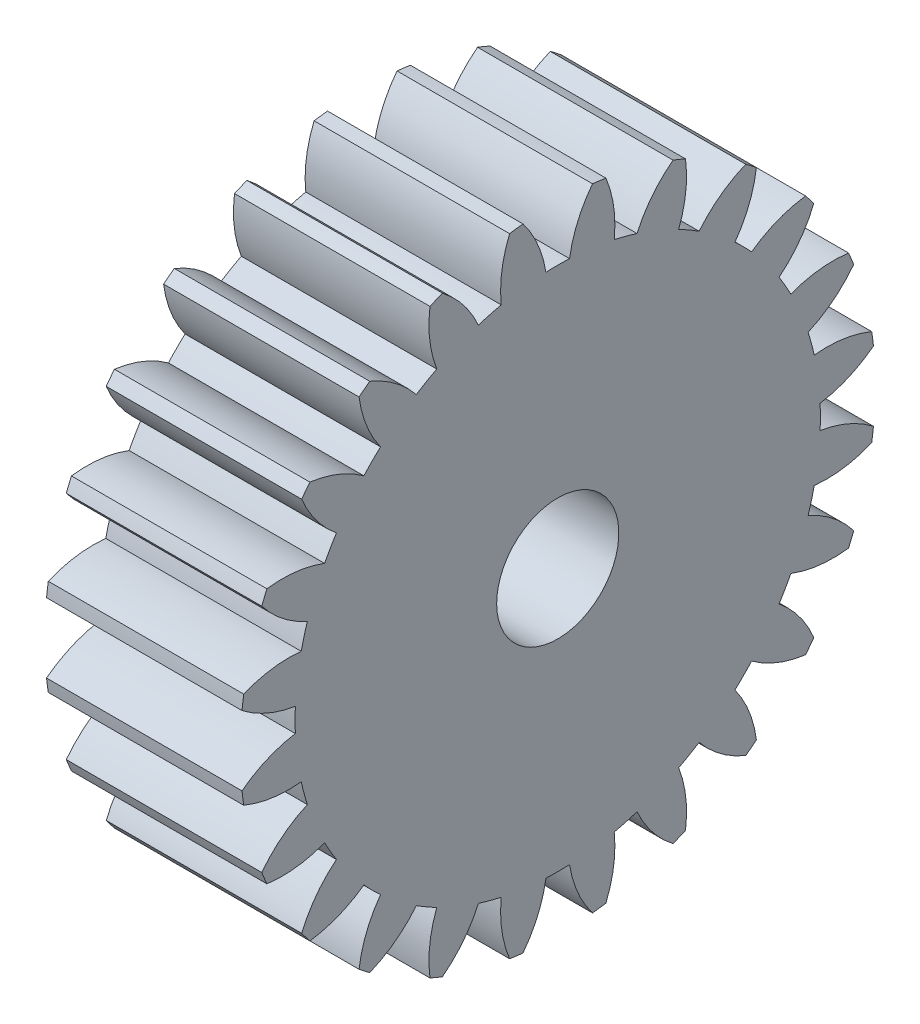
SolidWorks part; units mm, degrees
ref_plane "Plane1" through (0, 0, 0) normal (0, 0, 1) x (1, 0, 0)
ref_plane "Plane2" through (0, 0, 0) normal (0, 1, 0) x (1, 0, 0)
ref_plane "Plane3" through (0, 0, 0) normal (1, 0, 0) x (0, 0, -1)
sketch "HoldingSke" plane through (0, 0, 0) normal (0, 1, 0) x (1, 0, 0)
  line L0 (0, 0) -> (0.9135, -0.4067)
  line L1 (-15, 0) -> (100, 0) construction
  line L2 (0, 0) -> (-2.1039, 2.3779)
  line L3 (0, 0) -> (-11.863, 4.5341)
  line L4 (0, 0) -> (7.8894, 3.5126)
  line L5 (0, 0) -> (-46.8476, -17.4728)
  line L6 (0, 0) -> (-6.6317, -4.4744)
  line L7 (-2.1039, 2.3779) -> (8.6586, 51.2059)
  line L8 (-76.2, 54.61) -> (-75.3, 54.61)
  line L9 (-71.009, 38.7566) -> (-53.1078, 45.2721)
  line L10 (-76.2, 71.12) -> (104.1128, 71.12)
  line L11 (0, 0) -> (-8, 0)
  line L12 (-76.2, 101.6) -> (-76.162, 101.6)
  line L13 (24.9733, 27.94) -> (52.9518, 28.4284)
  line L14 (24.9733, 27.94) -> (24.9743, 27.94)
  line L15 (24.9733, 27.94) -> (100.4006, 29.5858)
  line L16 (-63.627, -1) -> (-12.827, -1)
  circle A0 centre (0, 0) radius 2.5
  circle A1 centre (0, 0) radius 10.749
  circle A2 centre (0, 0) radius 37.5
  circle A3 centre (0, 0) radius 2.5
sketch "BasProSke" plane through (0, 0, 0) normal (0, 1, 0) x (1, 0, 0)
  line L0 (-10, 0) -> (60, 0) construction
  line L1 (0, 0) -> (0, 13)
  line L2 (0, 0) -> (8, 0)
  line L3 (8, 0) -> (8, 13)
  line L4 (8, 13) -> (0, 13)
revolve "Base-Revolve" add sketch "BasProSke" angle 360 about L0
sketch "TooCutSke" plane through (0, 0, 0) normal (1, 0, 0) x (0, 0, -1)
  line L1 (0, 0) -> (0, 107) construction
  line L2 (0, 0) -> (-0.8513, 11.9698) construction
  line L3 (0, 0) -> (-3.127, 23.752) construction
  line L4 (-0.8513, 11.9698) -> (-1.5635, 11.876) construction
  arc A0 (0.4834, 10.7381) -> (-0.4834, 10.7381) centre (0, 0) ccw
  arc A1 (1.4409, 12.9455) -> (-1.4409, 12.9455) centre (0, 0) ccw
  circle A2 centre (0, 0) radius 12 construction
  circle A3 centre (0, 0) radius 11.2763 construction
  arc A4 (-0.4834, 10.7381) -> (-1.4409, 12.9455) centre (-5.2252, 9.9926) ccw
  arc A5 (1.4409, 12.9455) -> (0.4834, 10.7381) centre (5.2252, 9.9926) ccw
extrude "ToothCut" cut sketch "TooCutSke" along normal through all
fillet "Breaks" [suppressed] radius 0.02
fillet "RootFillets" [suppressed] radius 0.251
pattern_circular "TeethCuts" count 24 every 15 about axis through (-10, 0, 0) along (1, 0, 0) of "ToothCut", "RootFillets", "Breaks"
sketch "HubNeaOneSke" plane through (0, 0, 0) normal (-1, 0, 0) x (0, 0, 1)
  circle A0 centre (0, 0) radius 10.749
extrude "HubNearOne" [suppressed] add sketch "HubNeaOneSke" along normal blind 42.0001
sketch "HubNeaBotSke" plane through (0, 0, 0) normal (-1, 0, 0) x (0, 0, 1)
  circle A0 centre (0, 0) radius 10.749
extrude "HubNearBoth" [suppressed] add sketch "HubNeaBotSke" along normal blind 21
ref_plane "FarPln" through (8, 0, 0) normal (1, 0, 0) x (0, 0, -1)
sketch "HubFarSke" plane through (8, 0, 0) normal (1, 0, 0) x (0, 0, -1)
  circle A0 centre (0, 0) radius 10.749
extrude "HubFar" [suppressed] add sketch "HubFarSke" along normal blind 21
sketch "BorSke" plane through (0, 0, 0) normal (1, 0, 0) x (0, 0, -1)
  circle A0 centre (0, 0) radius 2.5
extrude "Bore" cut sketch "BorSke" along normal mid plane 100.0001
sketch "KeySke" plane through (0, 0, 0) normal (1, 0, 0) x (0, 0, -1)
  line L0 (-1, 0) -> (-1, 3.4)
  line L1 (-1, 3.4) -> (1, 3.4)
  line L2 (1, 3.4) -> (1, 0)
  line L3 (0, 0) -> (0, 34) construction
  line L4 (-1, 0) -> (1, 0)
extrude "Keyway" [suppressed] cut sketch "KeySke" along normal mid plane 100.0001
pattern_circular "Keyway2" [suppressed] count 2 every 90 about axis through (-10, 0, 0) along (1, 0, 0)
equation "' \"Module@HoldingSke\" = 6.35"
equation "' \"Num_teeth@HoldingSke\" = 12"
equation "' \"Ap@HoldingSke\" =  20"
equation "' \"Ap@HoldingSke\" = 20"
equation "' \"Width@HoldingSke\" = 0.5 * 25.4"
equation "' \"Hub_dia@HoldingSke\"= 1 * 25.4"
equation "' \"Hub_dia@HoldingSke\" = 1 * 25.4"
equation "' \"Overall_len@HoldingSke\" = 1.0 * 25.4"
equation "' \"Bore@HoldingSke\" = 0.75 * 25.4"
equation "' \"T_dim@HoldingSke\" = 0.1 * 25.4"
equation "' \"Width@KeySke\" = 0.25 * 25.4"
equation "' \"Show_teeth@HoldingSke\" = 13"
equation "' \"Backlash@HoldingSke\" = 0.009 * 25.4"
equation "' \"Addendum_fac@HoldingSke\" = 1.0"
equation "' \"Dedendum_fac@HoldingSke\" = 1.25"
equation "' \"Dedendum_add@HoldingSke\" = 0.00005 * 25.4"
equation "' \"Clearance_fac@HoldingSke\" = 0.25"
equation "\"Pitch@HoldingSke\" = 1 / \"Module@HoldingSke\""
equation "\"Overcut_dia@TooCutSke\" = (\"Num_teeth@HoldingSke\" + 2 * \"Addendum_fac@HoldingSke\") / \"Pitch@HoldingSke\" + 0.002 * 25.4"
equation "\"Pitch_dia@TooCutSke\" = \"Num_teeth@HoldingSke\" / \"Pitch@HoldingSke\""
equation "\"Base_dia@TooCutSke\" = \"Num_teeth@HoldingSke\" / \"Pitch@HoldingSke\" * cos((\"Ap@HoldingSke\"  * 3.14159265 / 180))"
equation "\"Root_dia@TooCutSke\" = (\"Num_teeth@HoldingSke\" + 2) / \"Pitch@HoldingSke\" - 2 * (\"Addendum_fac@HoldingSke\" + \"Dedendum_fac@HoldingSke\") / \"Pitch@HoldingSke\" - \"Dedendum_add@HoldingSke\" * 2"
equation "\"Half_ang@TooCutSke\" = 180 / \"Num_teeth@HoldingSke\""
equation "\"Half_CT@TooCutSke\" = \"Num_teeth@HoldingSke\" / \"Pitch@HoldingSke\" * sin((3.14159265 / 2 / \"Num_teeth@HoldingSke\")) / 2 - 7 * \"Backlash@HoldingSke\" / 4"
equation "\"Flank_rad@TooCutSke\" = \"Num_teeth@HoldingSke\" / \"Pitch@HoldingSke\" / 5"
equation "\"Radius@RootFillets\" = \"Clearance_fac@HoldingSke\" / \"Pitch@HoldingSke\" + \"Dedendum_add@HoldingSke\""
equation "\"Break_rad@Breaks\" = 0.02 / \"Pitch@HoldingSke\""
equation "\"Thickness@HoldingSke\" = \"Width@HoldingSke\""
equation "\"OAL@HoldingSke\" = \"Thickness@HoldingSke\""
equation "\"MHD@HoldingSke\" = (\"Num_teeth@HoldingSke\" + 2) / \"Pitch@HoldingSke\" - 2 * (\"Addendum_fac@HoldingSke\" + \"Dedendum_fac@HoldingSke\")  / \"Pitch@HoldingSke\" - \"Dedendum_add@HoldingSke\" * 2"
equation "\"MBD@HoldingSke\" = (\"Num_teeth@HoldingSke\" + 2) / \"Pitch@HoldingSke\" - 2 * (\"Addendum_fac@HoldingSke\" + \"Dedendum_fac@HoldingSke\")  / \"Pitch@HoldingSke\" - \"Dedendum_add@HoldingSke\" * 2 - 0.002 * 25.4"
equation "\"MHD@HoldingSke\" = ((sgn( \"MHD@HoldingSke\" - \"Hub_dia@HoldingSke\" )-1)*( \"MHD@HoldingSke\" - \"Hub_dia@HoldingSke\" ))/-2+ \"Hub_dia@HoldingSke\""
equation "\"MBD@HoldingSke\" = ((sgn( \"MBD@HoldingSke\" - \"Bore@HoldingSke\" )-1)*( \"MBD@HoldingSke\" - \"Bore@HoldingSke\" ))/-2+ \"Bore@HoldingSke\""
equation "\"OAL@HoldingSke\" = ((sgn( \"OAL@HoldingSke\" - \"Overall_len@HoldingSke\" )+1)*( \"OAL@HoldingSke\" - \"Overall_len@HoldingSke\" ))/2 + \"Overall_len@HoldingSke\" + 0.000002 * 25.4"
equation "\"Num_teeth@TeethCuts\" = int( \"Show_teeth@HoldingSke\" ) + 1"
equation "\"Num_teeth@TeethCuts\" = ((sgn( \"Num_teeth@TeethCuts\" - \"Num_teeth@HoldingSke\" )-1)*( \"Num_teeth@TeethCuts\" - \"Num_teeth@HoldingSke\" ))/-2+ \"Num_teeth@HoldingSke\""
equation "\"Num_teeth@TeethCuts\" = ((sgn( \"Num_teeth@TeethCuts\" - 2.0)+1)*( \"Num_teeth@TeethCuts\" - 2.0))/2 +2.0"
equation "\"Angle@TeethCuts\" = 360.0 / \"Num_teeth@HoldingSke\""
equation "\"Diameter@BasProSke\" = (\"Num_teeth@HoldingSke\" + 2 * \"Addendum_fac@HoldingSke\") / \"Pitch@HoldingSke\""
equation "\"Thickness@BasProSke\"  = \"Thickness@HoldingSke\""
equation "' \"Fillet_rad@BasProSke\" =  \"Thickness@HoldingSke\" * 0.05"
equation "' \"Fillet_rad@BasProSke\" = \"Thickness@HoldingSke\" * 0.05"
equation "\"MHD@HoldingSke\" = ((sgn( \"MHD@HoldingSke\" - \"Root_dia@TooCutSke\" )-1)*( \"MHD@HoldingSke\" - \"Root_dia@TooCutSke\" ))/-2+ \"Root_dia@TooCutSke\""
equation "\"Diameter@HubNeaOneSke\" = \"MHD@HoldingSke\""
equation "\"Length@HubNearOne\" = \"OAL@HoldingSke\" - \"Thickness@BasProSke\""
equation "\"Diameter@HubNeaBotSke\" = \"MHD@HoldingSke\""
equation "\"Length@HubNearBoth\" = ( \"OAL@HoldingSke\" - \"Thickness@BasProSke\" ) / 2.0"
equation "\"Thickness@FarPln\" = \"Thickness@BasProSke\""
equation "\"Diameter@HubFarSke\" = \"MHD@HoldingSke\""
equation "\"Length@HubFar\" = ( \"OAL@HoldingSke\" - \"Thickness@BasProSke\" ) / 2.0"
equation "\"Diameter@BorSke\" = \"MBD@HoldingSke\""
equation "\"D1@Bore\" = \"OAL@HoldingSke\" * 2.0"
equation "\"D1@Keyway\" = \"OAL@HoldingSke\" * 2.0"
equation "\"Offset@KeySke\" = \"T_dim@HoldingSke\" + \"MBD@HoldingSke\" / 2.0"
